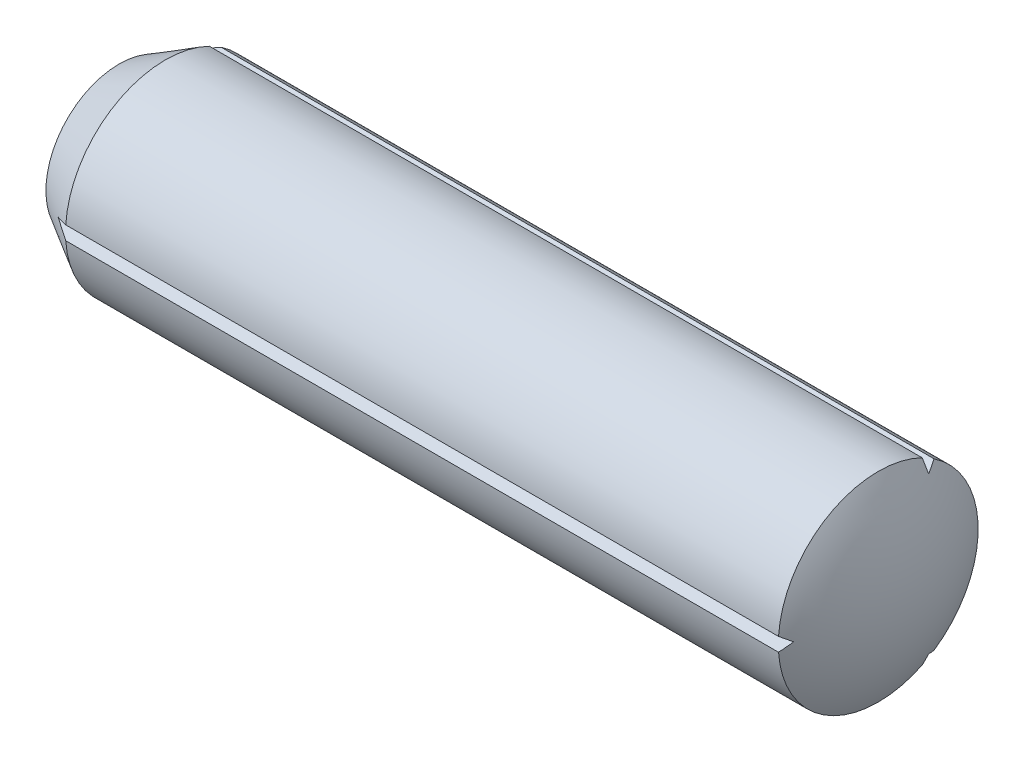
SolidWorks part; units mm, degrees
revolve "Base-Revolve" add sketch "Sketch1" angle 360 about L0
sketch "Sketch1" plane through (0, 0, 0) normal (0, 0, 1) x (1, 0, 0)
  line L0 (-117, 0) -> (21, 0) construction
  line L1 (-92.5, 12.5) -> (-98.295, 9.1543)
  line L2 (-92.5, 12.5) -> (-3.3494, 12.5)
  line L3 (-100, 0) -> (0, 0)
  line L4 (-100, 0) -> (-100, 1.25)
  arc A0 (-98.295, 9.1543) -> (-100, 1.25) centre (-75.0313, 0) ccw
  arc A1 (0, 0) -> (-3.3494, 12.5) centre (-25, 0) ccw
ref_plane "Plane1" through (0, 0, 0) normal (0, 0, 1) x (1, 0, 0)
ref_plane "Plane2" through (0, 0, 0) normal (0, 1, 0) x (1, 0, 0)
ref_plane "Plane3" through (0, 0, 0) normal (1, 0, 0) x (0, 0, -1)
sketch "Sketch2" plane through (0, 0, 0) normal (1, 0, 0) x (0, 0, -1)
  line L0 (0, 0) -> (-14, 0) construction
  line L1 (-11.25, 0) -> (-12.5, 0.8753)
  line L2 (-11.25, 0) -> (-12.5, -0.8753)
  line L3 (-12.5, -0.8753) -> (-12.5, 0.8753)
  circle A0 centre (0, 0) radius 11.25 construction
  circle A1 centre (0, 0) radius 12.5 construction
extrude "Cut-Extrude1" cut sketch "Sketch2" against normal through all
pattern_circular "CirPattern2" count 3 over 360 about axis through (0, 0, 0) along (1, 0, 0) of "Cut-Extrude1"
equation "\"D2@Sketch1\" = \"Diameter@Sketch1\""
equation "\"D1@Sketch2\" = \"Diameter@Sketch1\" * .9"
equation "\"D3@Sketch2\" = \"D2@Sketch2\" / 2"
equation "\"D1@Sketch1\" = \"Diameter@Sketch1\" * .1"
equation "\"D4@Sketch1\" = \"Diameter@Sketch1\""
